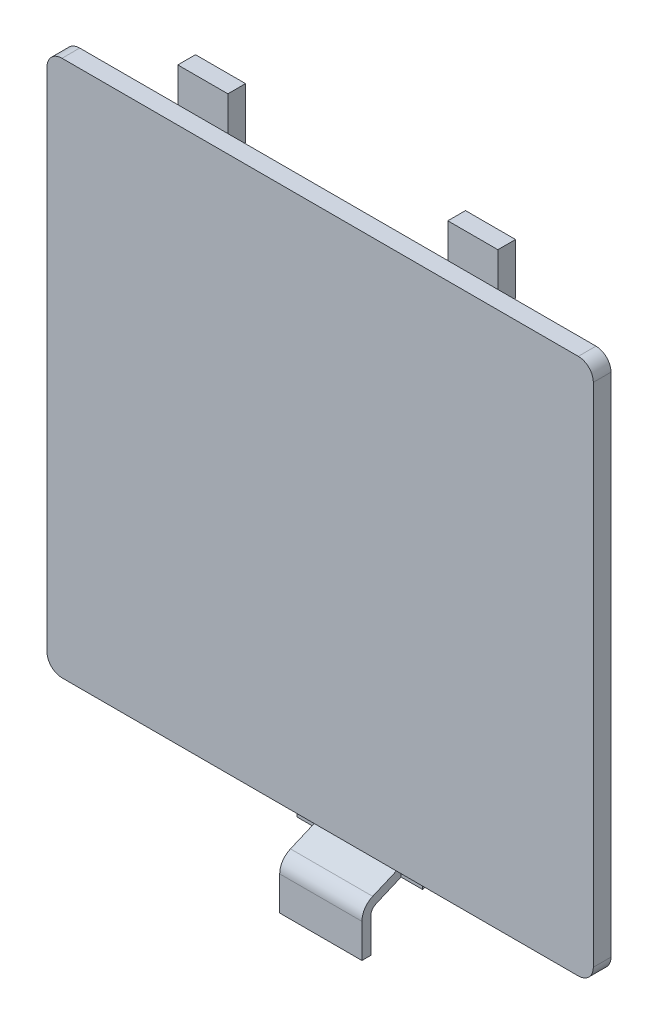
SolidWorks part; units mm, degrees
ref_plane "Plan de face" through (0, 0, 0) normal (0, 0, 1) x (1, 0, 0)
ref_plane "Plan de dessus" through (0, 0, 0) normal (0, 1, 0) x (1, 0, 0)
ref_plane "Plan de droite" through (0, 0, 0) normal (1, 0, 0) x (0, 0, -1)
sketch "Esquisse1" plane through (0, 0, 0) normal (0, 0, 1) x (1, 0, 0)
  line L16 (-29.2, -38.6483) -> (-7.85, -38.6483) construction
  line L17 (7.85, -38.6483) -> (29.2, -38.6483) construction
  line L18 (-31.2, 20.6517) -> (-31.2, -36.6483) construction
  line L19 (29.2, 22.6517) -> (-29.2, 22.6517) construction
  line L20 (31.2, -36.6483) -> (31.2, 20.6517) construction
  line L21 (-29.2, -38.6483) -> (7.85, -38.6483) construction
  line L22 (7.85, -38.6483) -> (29.2, -38.6483) construction
  line L23 (-31.2, 20.6517) -> (-31.2, -36.6483) construction
  line L24 (29.2, 22.6517) -> (-29.2, 22.6517) construction
  line L25 (31.2, -36.6483) -> (31.2, 20.6517) construction
  line L26 (-29.2, -38.3483) -> (7.85, -38.3483)
  line L27 (7.85, -38.3483) -> (29.2, -38.3483)
  line L28 (30.9, -36.6483) -> (30.9, 20.6517)
  line L29 (29.2, 22.3517) -> (-29.2, 22.3517)
  line L30 (-30.9, 20.6517) -> (-30.9, -36.6483)
  arc A12 (-31.2, -36.6483) -> (-29.2, -38.6483) centre (-29.2, -36.6483) ccw construction
  arc A13 (29.2, -38.6483) -> (31.2, -36.6483) centre (29.2, -36.6483) ccw construction
  arc A14 (-29.2, 22.6517) -> (-31.2, 20.6517) centre (-29.2, 20.6517) ccw construction
  arc A16 (31.2, 20.6517) -> (29.2, 22.6517) centre (29.2, 20.6517) ccw construction
  arc A17 (-31.2, -36.6483) -> (-29.2, -38.6483) centre (-29.2, -36.6483) ccw construction
  arc A18 (29.2, -38.6483) -> (31.2, -36.6483) centre (29.2, -36.6483) ccw construction
  arc A19 (-29.2, 22.6517) -> (-31.2, 20.6517) centre (-29.2, 20.6517) ccw construction
  arc A20 (31.2, 20.6517) -> (29.2, 22.6517) centre (29.2, 20.6517) ccw construction
  arc A21 (29.2, -38.3483) -> (30.9, -36.6483) centre (29.2, -36.6483) ccw
  arc A22 (30.9, 20.6517) -> (29.2, 22.3517) centre (29.2, 20.6517) ccw
  arc A23 (-29.2, 22.3517) -> (-30.9, 20.6517) centre (-29.2, 20.6517) ccw
  arc A24 (-30.9, -36.6483) -> (-29.2, -38.3483) centre (-29.2, -36.6483) ccw
  dimension "D1" = 0.3
extrude "Extrusion3" add sketch "Esquisse1" against normal up to surface (2 mm away)
sketch "Esquisse2" plane through (0, 0, -2) normal (0, 0, -1) x (-1, 0, 0)
  line L0 (0, 0) -> (0, 85.5097) construction
  line L1 (-18.1032, 20.4695) -> (-12.4392, 20.4695)
  line L2 (-18.1032, 20.4695) -> (-18.1032, 26.2495)
  line L3 (-18.1032, 26.2495) -> (-12.4392, 26.2495)
  line L4 (-12.4392, 20.4695) -> (-12.4392, 26.2495)
  line L5 (12.4392, 20.4695) -> (12.4392, 26.2495)
  line L6 (18.1032, 26.2495) -> (12.4392, 26.2495)
  line L7 (18.1032, 20.4695) -> (18.1032, 26.2495)
  line L8 (18.1032, 20.4695) -> (12.4392, 20.4695)
extrude "Extrusion4" add sketch "Esquisse2" along normal blind 2
sketch "Esquisse3" plane through (0, 0, 0) normal (1, 0, 0) x (0, 0, -1)
  line L0 (1.0732, -45.3093) -> (1.0732, -49.1483)
  line L2 (2, -37.4983) -> (9.2407, -37.4983)
  line L3 (2, -38.3483) -> (2, -36.6483) construction
  line L5 (1.6813, -44.3893) -> (9.93, -40.8763)
  line L6 (2, -38.3483) -> (0, -38.3483) construction
  arc A0 (9.2407, -37.4983) -> (9.93, -40.8763) centre (9.2407, -39.2576) cw
  arc A1 (1.6813, -44.3893) -> (1.0732, -45.3093) centre (2.0732, -45.3093) ccw
  point P2 (1, -38.3483)
  point P11 (1, -38.3483)
  point P14 (1.0732, -44.6483)
  dimension "D3" = 10
  dimension "D4" = 1
  dimension "D1" = 6.3
  dimension "D2" = 4.5
extrude "Extru.-Mince1" add sketch "Esquisse3" along normal blind 7.1 and the other way blind 7.1 thin
sketch "Esquisse5" plane through (0, -49.1483, 0) normal (0, -1, 0) x (1, 0, 0)
  line L0 (7.1, -0.0732) -> (-7.1, -0.0732) construction
  line L1 (4.65, -0.0732) -> (7.1, -0.0732)
  line L2 (4.65, -0.0732) -> (4.65, -4.5)
  line L3 (4.65, -4.5) -> (7.1, -4.5)
  line L4 (7.1, -0.0732) -> (7.1, -4.5)
  line L5 (-7.1, -11) -> (7.1, -11) construction
  line L6 (0, -0.0732) -> (0, -14.187) construction
  line L7 (-7.1, -0.0732) -> (-7.1, -4.5)
  line L8 (-4.65, -4.5) -> (-7.1, -4.5)
  line L9 (-4.65, -0.0732) -> (-4.65, -4.5)
  line L10 (-4.65, -0.0732) -> (-7.1, -0.0732)
  dimension "D1" = 6.5
  dimension "D2" = 9.3
extrude "Enlèv. mat.-Extru.1" cut sketch "Esquisse5" against normal up to next
